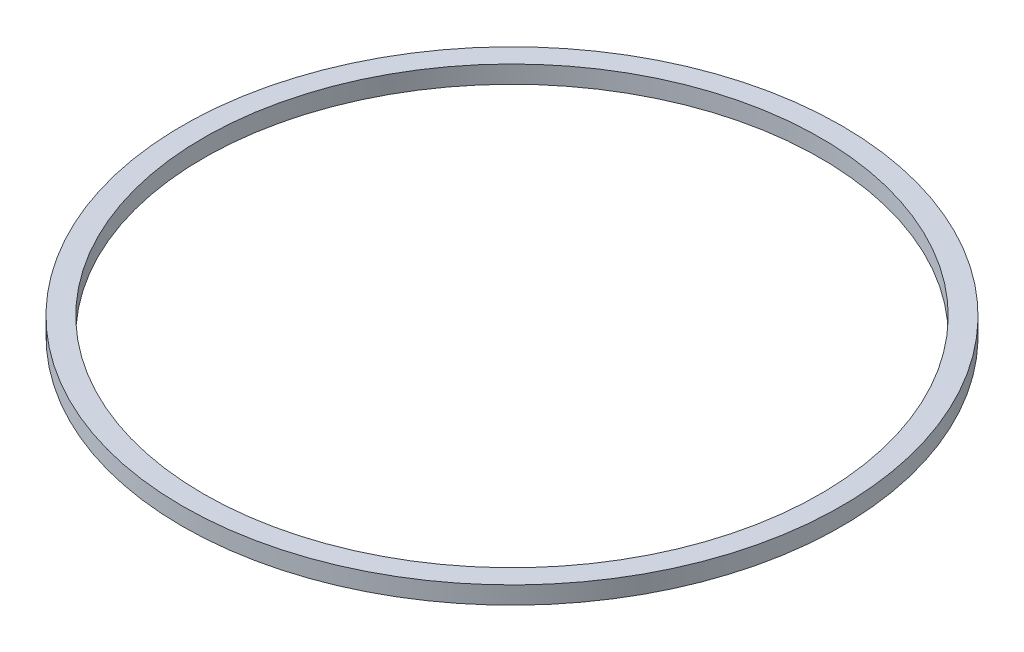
SolidWorks part; units mm, degrees
ref_plane "前视基准面" through (0, 0, 0) normal (0, 0, 1) x (1, 0, 0)
ref_plane "上视基准面" through (0, 0, 0) normal (0, 1, 0) x (1, 0, 0)
ref_plane "右视基准面" through (0, 0, 0) normal (1, 0, 0) x (0, 0, -1)
sketch "草图1" plane through (0, 0, 0) normal (0, 1, 0) x (1, 0, 0)
  circle A0 centre (0, 0) radius 18.759
  circle A1 centre (0, 0) radius 17.559
  dimension "D1" = 37.518
  dimension "D2" = 1.2
extrude "凸台-拉伸1" add sketch "草图1" along normal blind 1
